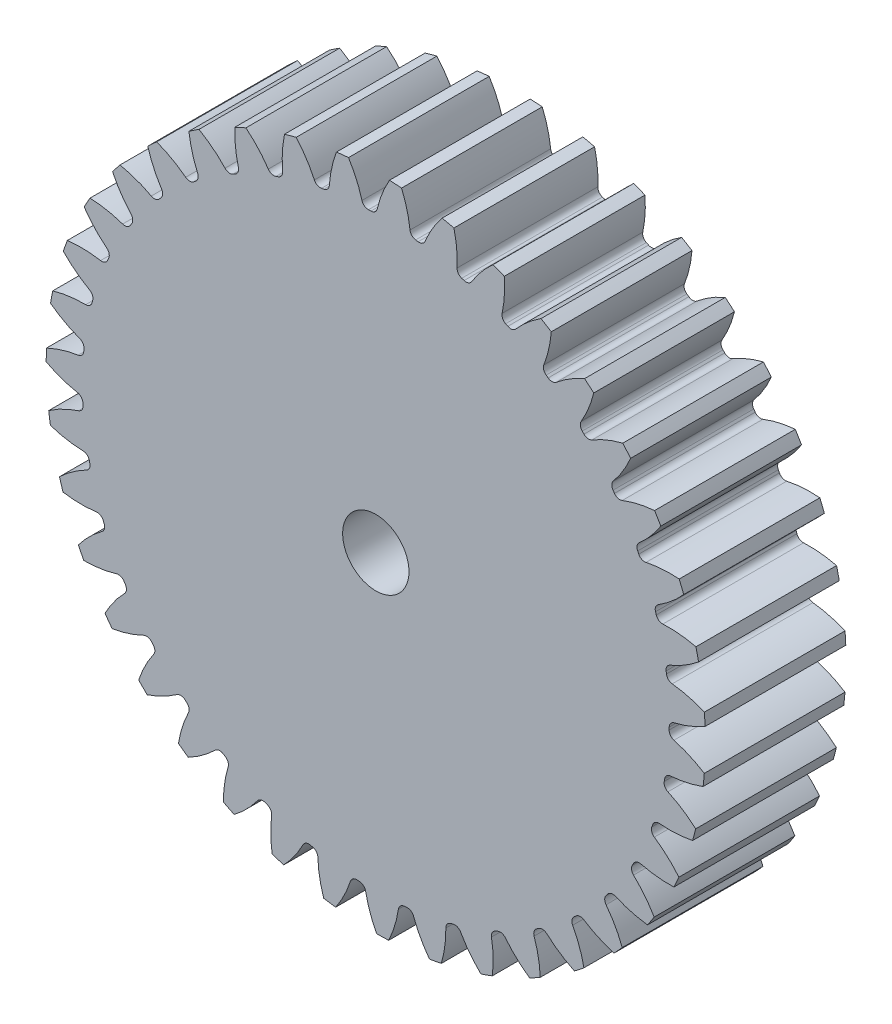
SolidWorks part; units mm, degrees
ref_plane "Front" through (0, 0, 0) normal (0, 0, 1) x (1, 0, 0)
ref_plane "Top" through (0, 0, 0) normal (0, 1, 0) x (1, 0, 0)
ref_plane "Right" through (0, 0, 0) normal (1, 0, 0) x (0, 0, -1)
sketch "Sketch3" plane through (0, 0, 0) normal (0, 0, 1) x (1, 0, 0)
  circle A0 centre (0, 0) radius 208.28
  dimension "od" = 416.56
extrude "gearBody" add sketch "Sketch3" along normal blind 88.9
sketch "Sketch2" plane through (0, 0, 0) normal (0, 0, 1) x (1, 0, 0)
  line L0 (0, 0) -> (172.0004, 71.2449) construction
  line L1 (207.7701, -17.1213) -> (0, 0) construction
  line L2 (0, 0) -> (36.3143, 0) construction
  line L3 (198.0779, 4.0829) -> (197.7676, -11.8108) construction
  line L5 (197.9228, -3.864) -> (0, 0) construction
  line L7 (0, 0) -> (186.1719, 0) construction
  arc A0 (186.1709, 0.6052) -> (186.0054, -7.871) centre (0, 0) ccw construction
  arc A1 (208.0902, 8.8887) -> (207.5848, -17.0038) centre (0, 0) ccw construction
  arc A2 (198.0779, 4.0829) -> (197.7676, -11.8108) centre (0, 0) ccw construction
  arc A3 (185.3676, -4.4091) -> (185.3984, -2.8292) centre (0, 0) ccw
  arc A4 (207.7701, -17.1213) -> (188.3935, -8.4914) centre (169.0886, -77.9038) ccw
  arc A5 (207.7701, -17.1213) -> (208.28, 8.9989) centre (0, 0) ccw
  arc A6 (208.28, 8.9989) -> (188.5814, 1.1318) centre (172.0004, 71.2449) cw
  arc A7 (185.3984, -2.8292) -> (188.5814, 1.1318) centre (189.5331, -2.8923) cw
  arc A8 (188.3935, -8.4914) -> (185.3676, -4.4091) centre (189.5015, -4.5074) cw
  point P6 (208.28, 8.9989)
  point P22 (207.7701, -17.1213)
  dimension "baseDia" = 372.3438
  dimension "od" = 416.56
  dimension "pd" = 396.24
  dimension "rd" = 370.84
  dimension "rFillet" = 4.1351
  dimension "pointX" = 208.28
  dimension "pointY" = 8.9989
  dimension "CTT" = 15.8937
  dimension "flankCenterAngle" = 22.5
extrude "toothCut" cut sketch "Sketch2" along normal through all
pattern_circular "CirPattern1" count 39 over 360 about axis through (0, 0, 0) along (0, 0, 1) of "toothCut"
sketch "hub1Dia" plane through (0, 0, 0) normal (0, 0, -1) x (-1, 0, 0)
  circle A0 centre (0, 0) radius 12.7
  dimension "hub1Dia" = 25.4
sketch "hub2Dia" plane through (0, 0, 88.9) normal (0, 0, 1) x (1, 0, 0)
  circle A0 centre (0, 0) radius 12.7
  dimension "hub2dia" = 25.4
sketch "boreDia" plane through (0, 0, 0) normal (0, 0, 1) x (1, 0, 0)
  circle A0 centre (0, 0) radius 20.955
  dimension "boreDia" = 41.91
extrude "bore" cut sketch "boreDia" against normal mid plane 25400
